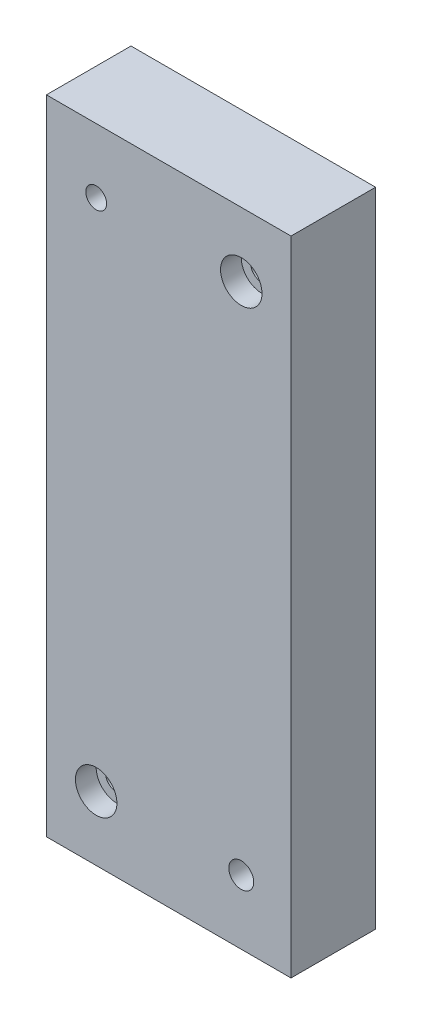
SolidWorks part; units mm, degrees
ref_plane "Plan de face" through (0, 0, 0) normal (0, 0, 1) x (1, 0, 0)
ref_plane "Plan de dessus" through (0, 0, 0) normal (0, 1, 0) x (1, 0, 0)
ref_plane "Plan de droite" through (0, 0, 0) normal (1, 0, 0) x (0, 0, -1)
sketch "Esquisse1" plane through (0, 0, 0) normal (0, 0, 1) x (1, 0, 0)
  line L1 (29.5, 77.5) -> (-29.5, 77.5)
  line L3 (-29.5, -77.5) -> (29.5, -77.5)
  line L4 (0, -128.0019) -> (0, 188.3465) construction
  line L5 (30, -78) -> (30, 78) construction
  line L6 (-30, 78) -> (-30, -78) construction
  line L7 (29.5, -77.5) -> (29.5, 77.5)
  line L8 (-29.5, -77.5) -> (-29.5, 77.5)
  line L9 (-30, -78) -> (-11, -78) construction
  line L10 (-11, 78) -> (-30, 78) construction
  circle A0 centre (-17.5, 62) radius 2.5035 construction
  circle A1 centre (-17.5, 62) radius 2.5035
  circle A2 centre (17.5, -62) radius 3.0035 construction
  circle A3 centre (17.5, -62) radius 3.0035
  dimension "D1" = 59
  dimension "D2" = 0.5
  dimension "D3" = 0.5
extrude "Extrusion1" add sketch "Esquisse1" along normal blind 20.4
hole_wizard "Chambrage pour vis à tête cylindrique à 6 pans creux (ou vis CHC) M51" positions "Esquisse3" profile "Esquisse2" counterbore size "M5" standard "Ansi Métrique"
sketch "Esquisse3" plane through (0, 0, 20.4) normal (0, 0, 1) x (1, 0, 0)
  point P0 (17.5, 62)
  point P1 (-17.5, -62)
sketch "Esquisse2" plane through (17.5, 62, 20.4) normal (1, 0, 0) x (0, -1, 0)
  line L0 (0, 0) -> (0, 20.4)
  line L1 (0, 20.4) -> (2.75, 20.4)
  line L3 (2.75, 20.4) -> (2.75, 5)
  line L4 (2.75, 5) -> (5, 5)
  line L5 (5, 5) -> (5, 0)
  line L7 (5, 0) -> (0, 0)
  line L11 (0, -6.35) -> (0, 107.95) construction
  dimension "Diamètre du perçage jusqu'au prochain" = 5.5
  dimension "Profondeur du perçage jusqu'au prochain" = 20.4
  dimension "Diamètre du chambrage" = 10
  dimension "Profondeur du chambrage" = 5
